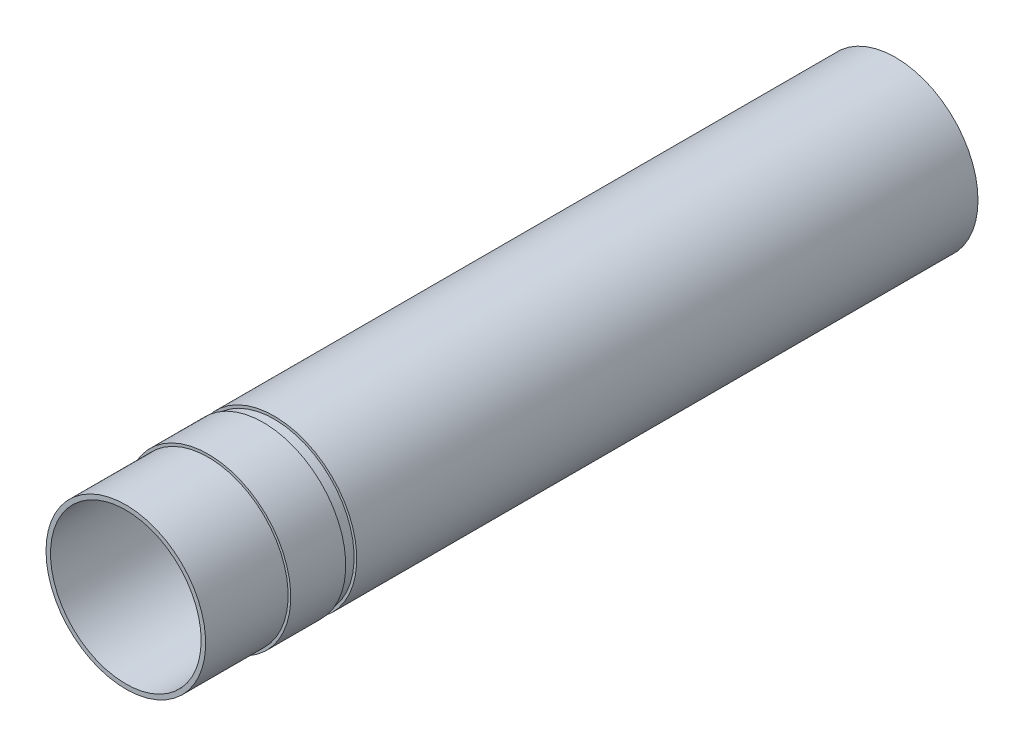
SolidWorks part; units mm, degrees
ref_plane "Front Plane" through (0, 0, 0) normal (0, 0, 1) x (1, 0, 0)
ref_plane "Top Plane" through (0, 0, 0) normal (0, 1, 0) x (1, 0, 0)
ref_plane "Right Plane" through (0, 0, 0) normal (1, 0, 0) x (0, 0, -1)
sketch "Sketch1" plane through (0, 0, 0) normal (0, 0, 1) x (1, 0, 0)
  line L0 (19.05, 0) -> (17.399, 0) construction
  line L1 (-19.05, 0) -> (19.05, 0) construction
  dimension "OD" = 38.1
  dimension "Wall Thickness" = 1.651
sketch "Sketch2" plane through (0, 0, 0) normal (1, 0, 0) x (0, 0, -1)
  line L0 (88.9, 0) -> (-88.9, 0)
  point P4 (0, 0)
  dimension "Length" = 177.8
sketch "Sketch3" plane through (0, 0, 0) normal (0, 0, 1) x (1, 0, 0)
  circle A0 centre (0, 0) radius 19.05
  circle A1 centre (0, 0) radius 17.399
extrude "Boss-Extrude1" add sketch "Sketch3" along normal up to vertex (88.9 mm away) and the other way up to vertex (88.9 mm away)
sketch "Sketch6" plane through (0, 0, 0) normal (1, 0, 0) x (0, 0, -1)
  line L0 (88.9, 19.05) -> (-88.9, 19.05) construction
  line L1 (-54.61, 19.05) -> (-57.15, 19.05)
  line L2 (-54.61, 19.05) -> (-54.61, 18.4404)
  line L3 (-54.61, 18.4404) -> (-57.15, 18.4404)
  line L4 (-57.15, 19.05) -> (-57.15, 18.4404)
  line L5 (0, 0) -> (-101.6259, 0) construction
  line L6 (-88.9, 19.05) -> (-88.9, -19.05) construction
  line L7 (88.9, -17.399) -> (88.9, 17.399) construction
  line L8 (-88.9, 19.05) -> (-69.85, 19.05)
  line L9 (-88.9, 19.05) -> (-88.9, 18.4404)
  line L10 (-88.9, 18.4404) -> (-69.85, 18.4404)
  line L11 (-69.85, 19.05) -> (-69.85, 18.4404)
  line L12 (48.26, 0) -> (50.8, 0)
  line L13 (48.26, 0) -> (48.26, 18.2626)
  line L14 (48.26, 18.2626) -> (50.8, 18.2626)
  line L15 (50.8, 0) -> (50.8, 18.2626)
  point P22 (49.53, 18.2626)
  dimension "D1" = 31.75
  dimension "D2" = 2.54
  dimension "D3" = 36.8808
  dimension "D4" = 19.05
  dimension "D5" = 2.54
  dimension "D6" = 38.1
  dimension "D7" = 36.5252
revolve "Cut-Revolve1" cut sketch "Sketch6" angle 360 about L5
